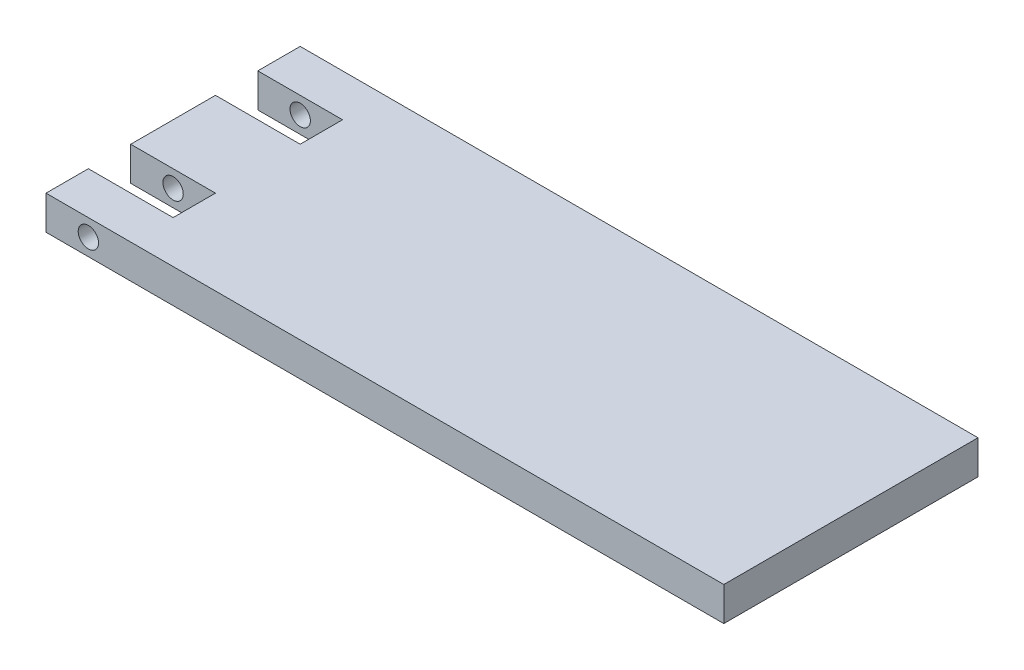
SolidWorks part; units mm, degrees
ref_plane "Piano frontale" through (0, 0, 0) normal (0, 0, 1) x (1, 0, 0)
ref_plane "Piano superiore" through (0, 0, 0) normal (0, 1, 0) x (1, 0, 0)
ref_plane "Piano destro" through (0, 0, 0) normal (1, 0, 0) x (0, 0, -1)
sketch "Schizzo1" plane through (0, 0, 0) normal (0, 1, 0) x (1, 0, 0)
  line L1 (0, 75) -> (400, 75)
  line L2 (0, 75) -> (0, -75)
  line L3 (0, -75) -> (400, -75)
  line L4 (400, 75) -> (400, -75)
  dimension "D1" = 400
  dimension "D2" = 150
extrude "Estrusione1" add sketch "Schizzo1" along normal blind 20
sketch "Schizzo2" plane through (0, 20, 0) normal (0, 1, 0) x (1, 0, 0)
  line L0 (0, 0) -> (400, 0) construction
  line L1 (0, 75) -> (0, -75) construction
  line L2 (400, -75) -> (400, 75) construction
  line L4 (0, 50) -> (50, 50)
  line L5 (0, 50) -> (0, 25)
  line L6 (0, 25) -> (50, 25)
  line L7 (50, 50) -> (50, 25)
  dimension "D1" = 50
  dimension "D2" = 25
  dimension "D3" = 50
extrude "Estrusione2" cut sketch "Schizzo2" against normal through all
ref_plane "Piano1" through (0, 0, 0) normal (0, 0, 1) x (1, 0, 0)
mirror "Specchia1" about plane through (0, 0, 0) normal (0, 0, 1) of "Estrusione2"
sketch "Schizzo3" plane through (0, 0, 75) normal (0, 0, 1) x (1, 0, 0)
  line L0 (0, 10) -> (25, 10) construction
  line L1 (0, 20) -> (0, 0) construction
  line L2 (0, 20) -> (50, 20) construction
  circle A0 centre (25, 10) radius 6
  point P7 (25, 20)
  dimension "D1" = 12
extrude "Estrusione3" cut sketch "Schizzo3" against normal through all
